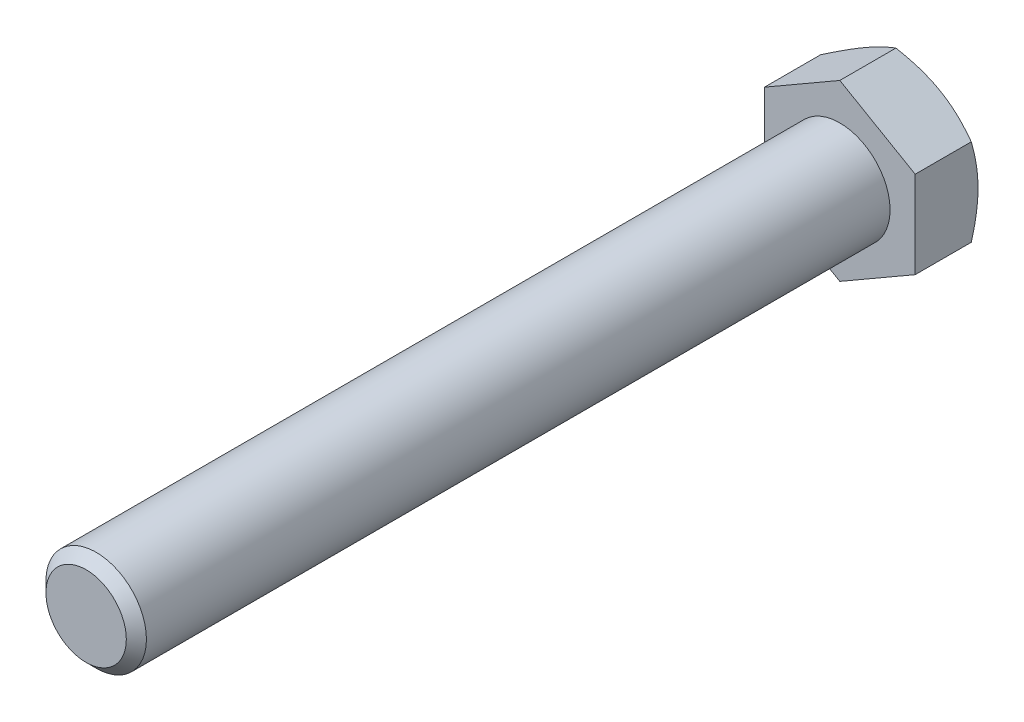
SolidWorks part; units mm, degrees
ref_plane "Plan1" through (0, 0, 0) normal (0, 0, 1) x (1, 0, 0)
ref_plane "Plan2" through (0, 0, 0) normal (0, 1, 0) x (1, 0, 0)
ref_plane "Plan3" through (0, 0, 0) normal (1, 0, 0) x (0, 0, -1)
sketch "Esquisse1" plane through (0, 0, 0) normal (0, 1, 0) x (1, 0, 0)
  line L1 (0, 0) -> (0, -90) construction
  line L2 (0, 0) -> (6, 0)
  line L3 (0, 0) -> (0, -90)
  line L4 (0, -90) -> (6, -90)
  line L6 (6, 0) -> (6, -90)
  dimension "D1" = 90
  dimension "D2" = 6
revolve "Base-Révolution" add sketch "Esquisse1" angle 360 about L1
chamfer "Chanfrein1" distance 1.2 angle 45 1 edges at (6, 0, 90)
sketch "Esquisse6" plane through (0, 0, 0) normal (0, 0, 1) x (1, 0, 0)
  line L0 (0, 0) -> (9, 0) construction
  line L1 (9, -5.1962) -> (9, 5.1962)
  line L2 (0, 0) -> (9, 5.1962) construction
  line L3 (0, 10.3923) -> (9, 5.1962)
  line L4 (0, -10.3923) -> (9, -5.1962)
  line L5 (0, 0) -> (0, 9) construction
  line L6 (-9, -5.1962) -> (-9, 5.1962)
  line L7 (-9, 5.1962) -> (0, 10.3923)
  line L8 (0, -10.3923) -> (-9, -5.1962)
  circle A0 centre (0, 0) radius 9 construction
  dimension "D2" = 30
  dimension "D1" = 18
extrude "Boss.-Extru.1" add sketch "Esquisse6" against normal blind 7.5
sketch "Esquisse7" plane through (0, 0, 0) normal (0, 1, 0) x (1, 0, 0)
  line L0 (-9, 7.5) -> (-21.9904, 7.5)
  line L1 (-9, 7.5) -> (-21.9904, 0)
  line L2 (-21.9904, 7.5) -> (-21.9904, 0)
  line L3 (0, 6.2394) -> (0, 0) construction
  line L4 (0, -88.8) -> (0, -90) construction
  dimension "D1" = 30
revolve "Enlèvement de matière-Révolution1" cut sketch "Esquisse7" angle 360 about L3
equation "\"D1@Chanfrein1\"=\"D2@Esquisse1\"*0.2"
equation "\"D2@Représentation de filetage1\"=\"D2@Esquisse1\"*1.6"
